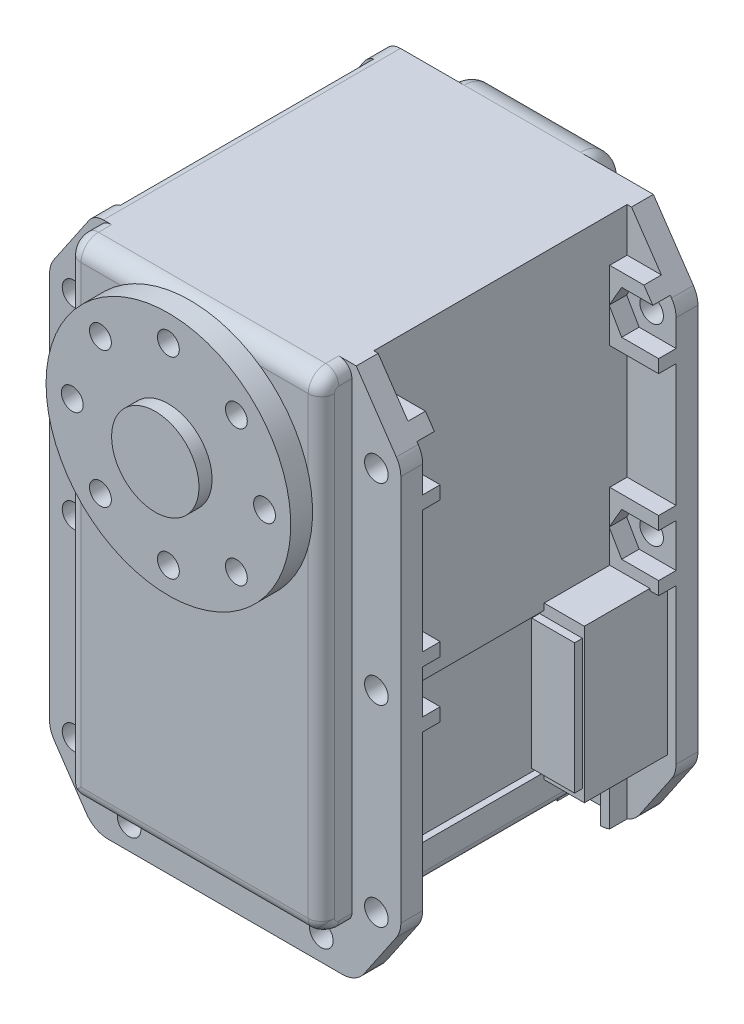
SolidWorks part; units mm, degrees
ref_plane "Front Plane" through (0, 0, 0) normal (0, 0, 1) x (1, 0, 0)
ref_plane "Top Plane" through (0, 0, 0) normal (0, 1, 0) x (1, 0, 0)
ref_plane "Right Plane" through (0, 0, 0) normal (1, 0, 0) x (0, 0, -1)
imported_body "Imported3"
sketch "Sketch1" plane through (0, 0, -12.5) normal (0, 0, 1) x (1, 0, 0)
  line L0 (14.5, -21.75) -> (19.1, -21.75)
  line L1 (19.1, -21.75) -> (19.1, -39.25)
  line L2 (19.1, -39.25) -> (14.5, -39.25)
  line L3 (14.5, -39.25) -> (14.5, -21.75)
extrude "Boss-Extrude1" add sketch "Sketch1" along normal blind 7.5
sketch "Sketch2" plane through (14.5, 0, 0) normal (1, 0, 0) x (0, 0, -1)
  line L0 (5, -22.475) -> (-12.5, -22.475)
  line L1 (-12.5, -22.475) -> (-12.5, -38.525)
  line L2 (-12.5, -38.525) -> (5, -38.525)
  line L3 (5, -38.525) -> (5, -22.475)
extrude "Cut-Extrude1" cut sketch "Sketch2" against normal blind 0.75
sketch "Sketch3" plane through (0, 0, -12.5) normal (0, 0, 1) x (1, 0, 0)
  line L0 (-14.5, -21.75) -> (-14.5, -39.25)
  line L1 (-14.5, -39.25) -> (-19.1, -39.25)
  line L2 (-19.1, -39.25) -> (-19.1, -21.75)
  line L3 (-19.1, -21.75) -> (-14.5, -21.75)
extrude "Boss-Extrude2" add sketch "Sketch3" along normal blind 7.5
sketch "Sketch4" plane through (-14.5, 0, 0) normal (-1, 0, 0) x (0, 0, 1)
  line L0 (-5, -38.525) -> (12.5, -38.525)
  line L1 (12.5, -38.525) -> (12.5, -22.475)
  line L2 (12.5, -22.475) -> (-5, -22.475)
  line L3 (-5, -22.475) -> (-5, -38.525)
extrude "Cut-Extrude2" cut sketch "Sketch4" against normal blind 0.75
ref_plane "Plane1" through (0, 0, 14.5) normal (0, 0, 1) x (1, 0, 0)
sketch "Sketch5" plane through (0, 0, 14.5) normal (0, 0, 1) x (1, 0, 0)
  line L0 (-20.1, 1.525) -> (-15.8711, 1.525)
  line L1 (-15.8711, 1.525) -> (-14.4421, 4)
  line L2 (-14.4421, 4) -> (-15.8711, 6.475)
  line L3 (-15.8711, 6.475) -> (-19.437, 6.475)
  line L4 (-19.437, 6.475) -> (-20.1, 5.5)
  line L5 (-20.1, 5.5) -> (-20.1, 1.525)
extrude "Cut-Extrude3" cut sketch "Sketch5" against normal up to next
sketch "Sketch6" plane through (0, 0, 14.5) normal (0, 0, 1) x (1, 0, 0)
  line L0 (19.437, 6.475) -> (15.8711, 6.475)
  line L1 (15.8711, 6.475) -> (14.4421, 4)
  line L2 (14.4421, 4) -> (15.8711, 1.525)
  line L3 (15.8711, 1.525) -> (20.1, 1.525)
  line L4 (20.1, 1.525) -> (20.1, 5.5)
  line L5 (20.1, 5.5) -> (19.437, 6.475)
extrude "Cut-Extrude4" cut sketch "Sketch6" against normal up to next
ref_plane "Plane2" through (0, 0, -14.5) normal (0, 0, -1) x (-1, 0, 0)
sketch "Sketch7" plane through (0, 0, -14.5) normal (0, 0, -1) x (-1, 0, 0)
  line L0 (20.1, 1.525) -> (20.1, 5.5)
  line L1 (20.1, 5.5) -> (19.437, 6.475)
  line L2 (19.437, 6.475) -> (15.8711, 6.475)
  line L3 (15.8711, 6.475) -> (14.4421, 4)
  line L4 (14.4421, 4) -> (15.8711, 1.525)
  line L5 (15.8711, 1.525) -> (20.1, 1.525)
extrude "Cut-Extrude5" cut sketch "Sketch7" against normal up to next
sketch "Sketch8" plane through (0, 0, -14.5) normal (0, 0, -1) x (-1, 0, 0)
  line L0 (-19.437, 6.475) -> (-20.1, 5.5)
  line L1 (-20.1, 5.5) -> (-20.1, 1.525)
  line L2 (-20.1, 1.525) -> (-15.8711, 1.525)
  line L3 (-15.8711, 1.525) -> (-14.4421, 4)
  line L4 (-14.4421, 4) -> (-15.8711, 6.475)
  line L5 (-15.8711, 6.475) -> (-19.437, 6.475)
extrude "Cut-Extrude6" cut sketch "Sketch8" against normal up to next
sketch "Sketch9" plane through (0, 0, 12.5) normal (0, 0, -1) x (-1, 0, 0)
  line L0 (14.4421, -18) -> (15.8711, -20.475)
  line L1 (15.8711, -20.475) -> (20.1, -20.475)
  line L2 (20.1, -20.475) -> (20.1, -15.525)
  line L3 (20.1, -15.525) -> (15.8711, -15.525)
  line L4 (15.8711, -15.525) -> (14.4421, -18)
extrude "Cut-Extrude7" cut sketch "Sketch9" against normal blind 2
sketch "Sketch10" plane through (0, 0, 12.5) normal (0, 0, -1) x (-1, 0, 0)
  line L0 (-14.4421, -18) -> (-15.8711, -15.525)
  line L1 (-15.8711, -15.525) -> (-20.1, -15.525)
  line L2 (-20.1, -15.525) -> (-20.1, -20.475)
  line L3 (-20.1, -20.475) -> (-15.8711, -20.475)
  line L4 (-15.8711, -20.475) -> (-14.4421, -18)
extrude "Cut-Extrude8" cut sketch "Sketch10" against normal blind 2
sketch "Sketch11" plane through (0, 0, -12.5) normal (0, 0, 1) x (1, 0, 0)
  line L0 (-20.1, -20.475) -> (-15.8711, -20.475)
  line L1 (-15.8711, -20.475) -> (-14.4421, -18)
  line L2 (-14.4421, -18) -> (-15.8711, -15.525)
  line L3 (-15.8711, -15.525) -> (-20.1, -15.525)
  line L4 (-20.1, -15.525) -> (-20.1, -20.475)
extrude "Cut-Extrude9" cut sketch "Sketch11" against normal blind 2
sketch "Sketch12" plane through (0, 0, -12.5) normal (0, 0, 1) x (1, 0, 0)
  line L0 (20.1, -15.525) -> (15.8711, -15.525)
  line L1 (15.8711, -15.525) -> (14.4421, -18)
  line L2 (14.4421, -18) -> (15.8711, -20.475)
  line L3 (15.8711, -20.475) -> (20.1, -20.475)
  line L4 (20.1, -20.475) -> (20.1, -15.525)
extrude "Cut-Extrude10" cut sketch "Sketch12" against normal blind 2
sketch "Sketch13" plane through (0, -39.25, 0) normal (0, -1, 0) x (1, 0, 0)
  line L0 (-19.1, -12.5) -> (-20.1, -12.5)
  line L1 (-20.1, -12.5) -> (-20.1, -14.5)
  line L2 (-20.1, -14.5) -> (-19.1, -14.5)
  line L3 (-19.1, -14.5) -> (-19.1, -12.5)
extrude "Cut-Extrude11" cut sketch "Sketch13" against normal blind 17.275
sketch "Sketch14" plane through (0, -39.25, 0) normal (0, -1, 0) x (1, 0, 0)
  line L0 (19.1, -14.5) -> (20.1, -14.5)
  line L1 (20.1, -14.5) -> (20.1, -12.5)
  line L2 (20.1, -12.5) -> (19.1, -12.5)
  line L3 (19.1, -12.5) -> (19.1, -14.5)
extrude "Cut-Extrude12" cut sketch "Sketch14" against normal blind 17.275
sketch "Sketch15" plane through (20.1, 0, 0) normal (1, 0, 0) x (0, 0, -1)
  line L0 (12.5, -14.025) -> (14.5, -14.025)
  line L1 (14.5, -14.025) -> (14.5, 0.025)
  line L2 (14.5, 0.025) -> (12.5, 0.025)
  line L3 (12.5, 0.025) -> (12.5, -14.025)
extrude "Cut-Extrude13" cut sketch "Sketch15" against normal blind 5.6
ref_plane "Plane3" through (16.302, 11.0853, 0) normal (0.8269, 0.5623, 0) x (-0.5623, 0.8269, 0)
ref_plane "Plane4" through (14.5, 0, 0) normal (-1, 0, 0) x (0, -1, 0)
sketch "Sketch17" plane through (14.5, 0, 0) normal (-1, 0, 0) x (0, -1, 0)
  line L0 (-7.975, -12.5) -> (-13, -12.5)
  line L1 (-13, -12.5) -> (-13, -14.5)
  line L2 (-13, -14.5) -> (-7.975, -14.5)
  line L3 (-7.975, -14.5) -> (-7.975, -12.5)
extrude "Cut-Extrude14" cut sketch "Sketch17" against normal up to surface
ref_plane "Plane5" through (-16.302, 11.0853, 0) normal (-0.8269, 0.5623, 0) x (-0.5623, -0.8269, 0)
ref_plane "Plane6" through (-14.5, 0, 0) normal (1, 0, 0) x (0, 0, -1)
sketch "Sketch19" plane through (-14.5, 0, 0) normal (1, 0, 0) x (0, 0, -1)
  line L0 (12.5, 13) -> (12.5, 7.975)
  line L1 (12.5, 7.975) -> (14.5, 7.975)
  line L2 (14.5, 7.975) -> (14.5, 13)
  line L3 (14.5, 13) -> (12.5, 13)
extrude "Cut-Extrude15" cut sketch "Sketch19" against normal up to surface
sketch "Sketch20" plane through (20.1, 0, 0) normal (1, 0, 0) x (0, 0, -1)
  line L0 (-12.5, 0.025) -> (-14.5, 0.025)
  line L1 (-14.5, 0.025) -> (-14.5, -14.025)
  line L2 (-14.5, -14.025) -> (-12.5, -14.025)
  line L3 (-12.5, -14.025) -> (-12.5, 0.025)
extrude "Cut-Extrude16" cut sketch "Sketch20" against normal blind 5.6
sketch "Sketch22" plane through (14.5, 0, 0) normal (-1, 0, 0) x (0, -1, 0)
  line L0 (-7.975, 12.5) -> (-7.975, 14.5)
  line L1 (-7.975, 14.5) -> (-13, 14.5)
  line L2 (-13, 14.5) -> (-13, 12.5)
  line L3 (-13, 12.5) -> (-7.975, 12.5)
extrude "Cut-Extrude17" cut sketch "Sketch22" against normal up to surface
sketch "Sketch24" plane through (-14.5, 0, 0) normal (1, 0, 0) x (0, 0, -1)
  line L0 (-12.5, 13) -> (-14.5, 13)
  line L1 (-14.5, 13) -> (-14.5, 7.975)
  line L2 (-14.5, 7.975) -> (-12.5, 7.975)
  line L3 (-12.5, 7.975) -> (-12.5, 13)
extrude "Cut-Extrude18" cut sketch "Sketch24" against normal up to surface
sketch "Sketch25" plane through (0, 0, 12.5) normal (0, 0, -1) x (-1, 0, 0)
  line L0 (14.5, 0.025) -> (14.5, -14.025)
  line L1 (14.5, -14.025) -> (20.1, -14.025)
  line L2 (20.1, -14.025) -> (20.1, 0.025)
  line L3 (20.1, 0.025) -> (14.5, 0.025)
extrude "Cut-Extrude19" cut sketch "Sketch25" against normal blind 2
sketch "Sketch26" plane through (-20.1, 0, 0) normal (-1, 0, 0) x (0, 0, 1)
  line L0 (-12.5, 0.025) -> (-14.5, 0.025)
  line L1 (-14.5, 0.025) -> (-14.5, -14.025)
  line L2 (-14.5, -14.025) -> (-12.5, -14.025)
  line L3 (-12.5, -14.025) -> (-12.5, 0.025)
extrude "Cut-Extrude20" cut sketch "Sketch26" against normal blind 5.6
sketch "Sketch27" plane through (0, 0, 12.5) normal (0, 0, -1) x (-1, 0, 0)
  line L0 (8.525, -43.8711) -> (8.525, -48.1)
  line L1 (8.525, -48.1) -> (13.475, -48.1)
  line L2 (13.475, -48.1) -> (13.475, -43.8711)
  line L3 (13.475, -43.8711) -> (11, -42.4421)
  line L4 (11, -42.4421) -> (8.525, -43.8711)
extrude "Cut-Extrude21" cut sketch "Sketch27" against normal blind 2
sketch "Sketch28" plane through (0, 0, 12.5) normal (0, 0, -1) x (-1, 0, 0)
  line L0 (-13.475, -43.8711) -> (-13.475, -48.1)
  line L1 (-13.475, -48.1) -> (-8.525, -48.1)
  line L2 (-8.525, -48.1) -> (-8.525, -43.8711)
  line L3 (-8.525, -43.8711) -> (-11, -42.4421)
  line L4 (-11, -42.4421) -> (-13.475, -43.8711)
extrude "Cut-Extrude22" cut sketch "Sketch28" against normal blind 2
sketch "Sketch29" plane through (0, 0, -12.5) normal (0, 0, 1) x (1, 0, 0)
  line L0 (-13.475, -48.1) -> (-8.525, -48.1)
  line L1 (-8.525, -48.1) -> (-8.525, -43.8711)
  line L2 (-8.525, -43.8711) -> (-11, -42.4421)
  line L3 (-11, -42.4421) -> (-13.475, -43.8711)
  line L4 (-13.475, -43.8711) -> (-13.475, -48.1)
extrude "Cut-Extrude23" cut sketch "Sketch29" against normal blind 2
sketch "Sketch30" plane through (0, 0, -12.5) normal (0, 0, 1) x (1, 0, 0)
  line L0 (8.525, -48.1) -> (13.475, -48.1)
  line L1 (13.475, -48.1) -> (13.475, -43.8711)
  line L2 (13.475, -43.8711) -> (11, -42.4421)
  line L3 (11, -42.4421) -> (8.525, -43.8711)
  line L4 (8.525, -43.8711) -> (8.525, -48.1)
extrude "Cut-Extrude24" cut sketch "Sketch30" against normal blind 2
sketch "Sketch31" plane through (0, 0, 12.5) normal (0, 0, -1) x (-1, 0, 0)
  line L0 (-7.025, -48.1) -> (7.025, -48.1)
  line L1 (7.025, -48.1) -> (7.025, -42.5)
  line L2 (7.025, -42.5) -> (-7.025, -42.5)
  line L3 (-7.025, -42.5) -> (-7.025, -48.1)
extrude "Cut-Extrude25" cut sketch "Sketch31" against normal blind 2
sketch "Sketch32" plane through (0, -48.1, 0) normal (0, -1, 0) x (1, 0, 0)
  line L0 (-7.025, -12.5) -> (-7.025, -14.5)
  line L1 (-7.025, -14.5) -> (7.025, -14.5)
  line L2 (7.025, -14.5) -> (7.025, -12.5)
  line L3 (7.025, -12.5) -> (-7.025, -12.5)
extrude "Cut-Extrude26" cut sketch "Sketch32" against normal blind 5.6
sketch "Sketch33" plane through (0, 0, -5) normal (0, 0, 1) x (1, 0, 0)
  line L0 (18.88, -37.95) -> (13.98, -37.95)
  line L1 (13.98, -37.95) -> (13.98, -23.05)
  line L2 (13.98, -23.05) -> (18.88, -23.05)
  line L3 (18.88, -23.05) -> (18.88, -37.95)
extrude "Boss-Extrude3" add sketch "Sketch33" along normal blind 0.9
sketch "Sketch34" plane through (0, 0, -5) normal (0, 0, 1) x (1, 0, 0)
  line L0 (-18.88, -37.95) -> (-18.88, -23.05)
  line L1 (-18.88, -23.05) -> (-13.98, -23.05)
  line L2 (-13.98, -23.05) -> (-13.98, -37.95)
  line L3 (-13.98, -37.95) -> (-18.88, -37.95)
extrude "Boss-Extrude4" add sketch "Sketch34" along normal blind 0.9
hole_wizard "Ø15.0 (15) Diameter Hole1" positions "Sketch36" profile "Sketch35" hole size "Ø15.0" standard "ANSI Metric"
sketch "Sketch36" plane through (0, 0, -20.5) normal (0, 0, -1) x (-1, 0, 0)
  point P0 (0, 0)
sketch "Sketch35" plane through (0, 0, -20.5) normal (1, 0, 0) x (0, 1, 0)
  line L0 (0, 0) -> (0, 1)
  line L1 (0, 1) -> (7.5, 1)
  line L2 (7.5, 1) -> (7.5, 0)
  line L5 (7.5, 0) -> (0, 0)
  line L10 (0, 1) -> (-7.5, 1) construction
  line L11 (0, -6.35) -> (0, 107.95) construction
  dimension "Hole Dia." = 15
  dimension "Hole Depth" = 1
  dimension "Drill Angle" = 180
ref_plane "Plane7" through (0, 0, 0) normal (0, -1, 0) x (1, 0, 0)
sketch "Sketch37" plane through (0, 0, 0) normal (0, -1, 0) x (1, 0, 0)
  line L0 (2.75, 28) -> (0, 28)
  line L1 (0, 28) -> (0, 20.5)
  line L2 (0, 20.5) -> (5.5, 20.5)
  line L3 (5.5, 20.5) -> (5.5, 21)
  line L4 (5.5, 21) -> (14, 21)
  line L5 (14, 21) -> (14, 23.5)
  line L6 (14, 23.5) -> (5, 23.5)
  line L7 (5, 23.5) -> (5, 25)
  line L8 (5, 25) -> (2.75, 25)
  line L9 (2.75, 25) -> (2.75, 28)
  line L10 (0, 28) -> (0, 20.5) construction
revolve "Revolve1" add sketch "Sketch37" angle 360 about L10
sketch "Sketch38" plane through (0, 0, 0) normal (0, -1, 0) x (1, 0, 0)
  line L0 (5, -19.5) -> (0, -19.5)
  line L1 (0, -19.5) -> (0, -22)
  line L2 (0, -22) -> (4, -22)
  line L3 (4, -22) -> (4, -19.8)
  line L4 (4, -19.8) -> (5, -19.8)
  line L5 (5, -19.8) -> (5, -19.5)
  line L6 (0, -19.5) -> (0, -22) construction
revolve "Revolve2" add sketch "Sketch38" angle 360 about L6
hole_wizard "Ø2.7 (2.7) Diameter Hole1" positions "Sketch40" profile "Sketch39" hole size "Ø2.7" standard "ANSI Metric"
sketch "Sketch40" plane through (0, 0, -14.5) normal (0, 0, 1) x (1, 0, 0)
  point P0 (-17.3, 4)
  point P1 (-17.3, -18)
  point P2 (-11, -45.3)
  point P3 (17.3, 4)
  point P4 (17.3, -18)
  point P5 (11, -45.3)
sketch "Sketch39" plane through (-17.3, 4, -14.5) normal (1, 0, 0) x (0, -1, 0)
  line L0 (0, 0) -> (0, 7.5321)
  line L1 (0, 7.5321) -> (1.35, 7.5321)
  line L2 (1.35, 7.5321) -> (1.35, 0)
  line L5 (1.35, 0) -> (0, 0)
  line L11 (0, -6.35) -> (0, 107.95) construction
  dimension "Thru Hole Dia." = 2.7
  dimension "Thru Hole Depth" = 7.5321
hole_wizard "Ø2.7 (2.7) Diameter Hole2" positions "Sketch42" profile "Sketch41" hole size "Ø2.7" standard "ANSI Metric"
sketch "Sketch42" plane through (0, 0, 14.5) normal (0, 0, -1) x (-1, 0, 0)
  point P0 (17.3, 4)
  point P1 (17.3, -18)
  point P2 (11, -45.3)
  point P3 (-17.3, 4)
  point P4 (-17.3, -18)
  point P5 (-11, -45.3)
sketch "Sketch41" plane through (-17.3, 4, 14.5) normal (1, 0, 0) x (0, 1, 0)
  line L0 (0, 0) -> (0, 13.5)
  line L1 (0, 13.5) -> (1.35, 13.5)
  line L2 (1.35, 13.5) -> (1.35, 0)
  line L5 (1.35, 0) -> (0, 0)
  line L11 (0, -6.35) -> (0, 107.95) construction
  dimension "Thru Hole Dia." = 2.7
  dimension "Thru Hole Depth" = 13.5
hole_wizard "Ø3.2 (3.2) Diameter Hole1" positions "Sketch44" profile "Sketch43" hole size "Ø3.2" standard "ANSI Metric"
sketch "Sketch44" plane through (0, 0, -22) normal (0, 0, -1) x (-1, 0, 0)
  point P0 (0, 0)
sketch "Sketch43" plane through (0, 0, -22) normal (1, 0, 0) x (0, 1, 0)
  line L0 (0, 0) -> (0, 2.2)
  line L1 (0, 2.2) -> (1.6, 2.2)
  line L2 (1.6, 2.2) -> (1.6, 0)
  line L5 (1.6, 0) -> (0, 0)
  line L10 (0, 2.2) -> (-1.6, 2.2) construction
  line L11 (0, -6.35) -> (0, 107.95) construction
  dimension "Hole Dia." = 3.2
  dimension "Hole Depth" = 2.2
  dimension "Drill Angle" = 180
sketch "Sketch45" plane through (0, 0, 0) normal (0, 0, 1) x (1, 0, 0)
  line L0 (-14.4421, 4) -> (-14.5, 4.1003)
  line L1 (-14.5, 4.1003) -> (-14.5, 3.8997)
rib "Rib1" sketch "Sketch45" sketch "Sketch45" thickness 25 extrusion direction parallel to sketch draft on no parameters "D1"=25
sketch "Sketch46" plane through (0, 0, 0) normal (0, 0, 1) x (1, 0, 0)
  line L0 (-14.4421, -18) -> (-14.5, -17.8997)
  line L1 (-14.5, -17.8997) -> (-14.5, -18.1003)
rib "Rib2" sketch "Sketch46" sketch "Sketch46" thickness 25 extrusion direction parallel to sketch draft on no parameters "D1"=25
ref_plane "Plane8" through (0, 0, 0) normal (0, 0, -1) x (-1, 0, 0)
sketch "Sketch47" plane through (0, 0, 0) normal (0, 0, -1) x (-1, 0, 0)
  line L0 (-14.4421, 4) -> (-14.5, 4.1003)
  line L1 (-14.5, 4.1003) -> (-14.5, 3.8997)
rib "Rib3" sketch "Sketch47" sketch "Sketch47" thickness 25 extrusion direction parallel to sketch draft on no parameters "D1"=25
sketch "Sketch48" plane through (0, 0, 0) normal (0, 0, -1) x (-1, 0, 0)
  line L0 (-14.4421, -18) -> (-14.5, -17.8997)
  line L1 (-14.5, -17.8997) -> (-14.5, -18.1003)
rib "Rib4" sketch "Sketch48" sketch "Sketch48" thickness 25 extrusion direction parallel to sketch draft on no parameters "D1"=25
sketch "Sketch49" plane through (0, 0, 0) normal (0, 0, 1) x (1, 0, 0)
  line L0 (-11, -42.4421) -> (-11.1003, -42.5)
  line L1 (-11.1003, -42.5) -> (-10.8997, -42.5)
rib "Rib5" sketch "Sketch49" sketch "Sketch49" thickness 25 extrusion direction parallel to sketch draft on no parameters "D1"=25
sketch "Sketch50" plane through (0, 0, 0) normal (0, 0, -1) x (-1, 0, 0)
  line L0 (-11, -42.4421) -> (-11.1003, -42.5)
  line L1 (-11.1003, -42.5) -> (-10.8997, -42.5)
rib "Rib6" sketch "Sketch50" sketch "Sketch50" thickness 25 extrusion direction parallel to sketch draft on no parameters "D1"=25
fillet "Fillet1" radius 1.5 5 edges at (-14.5, -14.75, -20.5) (14.5, -14.75, -20.5) (-14.5, -15, 20.5) (-14.5, 12.4142, 19.9142) (-14.5, 13, 17.75)
fillet "Fillet3" radius 2 1 edges at (-15, 13, 15.75)
fillet "Fillet4" radius 3 12 edges at (-20.1, 5.5, -15.75) (20.1, -40.6, -15.75) (-15, -48.1, -15.75) (-20.1, 5.5, 15.75) (20.1, 5.5, 15.75) (-20.1, -40.6, 15.75) (-20.1, -40.6, -15.75) (-15, -48.1, 15.75) (15, -48.1, -15.75) (15, -48.1, 15.75) (20.1, -40.6, 15.75) (20.1, 5.5, -15.75)
fillet "Fillet5" radius 1 4 edges at (-14.5, -42.5, 0) (14.5, -42.5, 0)
sketch "Sketch51" plane through (0, 0, 17) normal (0, 0, 1) x (1, 0, 0)
  line L0 (17.3, 4) -> (17.3, -40) construction
  line L1 (0, -42.5) -> (0, -48.1) construction
  line L2 (-13.5, -42.5) -> (13.5, -42.5) construction
  line L3 (-13.4121, -48.1) -> (13.4121, -48.1) construction
  circle A0 centre (17.3, -18) radius 1.35 construction
  circle A1 centre (17.3, -40) radius 1.35
  circle A2 centre (-17.3, -40) radius 1.35
  dimension "D1" = 22
extrude "Cut-Extrude27" cut sketch "Sketch51" against normal up to surface (2.5 mm away)
sketch "Sketch52" plane through (0, 0, 23.5) normal (0, 0, 1) x (1, 0, 0)
  line L0 (0, 0) -> (0, 14) construction
  circle A0 centre (0, 0) radius 14 construction
  circle A1 centre (0, 11) radius 1.25
  circle A2 centre (7.7782, 7.7782) radius 1.25
  circle A3 centre (11, 0) radius 1.25
  circle A4 centre (7.7782, -7.7782) radius 1.25
  circle A5 centre (0, -11) radius 1.25
  circle A6 centre (-7.7782, -7.7782) radius 1.25
  circle A7 centre (-11, 0) radius 1.25
  circle A8 centre (-7.7782, 7.7782) radius 1.25
  point P24 (0, 0)
  dimension "D1" = 2.5
  dimension "D2" = 11
  dimension "D3" = 8
extrude "Cut-Extrude28" cut sketch "Sketch52" against normal up to surface (2.5 mm away)
sketch "Sketch53" plane through (0, 0, 28) normal (0, 0, 1) x (1, 0, 0)
  circle A0 centre (0, 0) radius 2.75
extrude "Cut-Extrude29" cut sketch "Sketch53" against normal up to surface (3 mm away)
